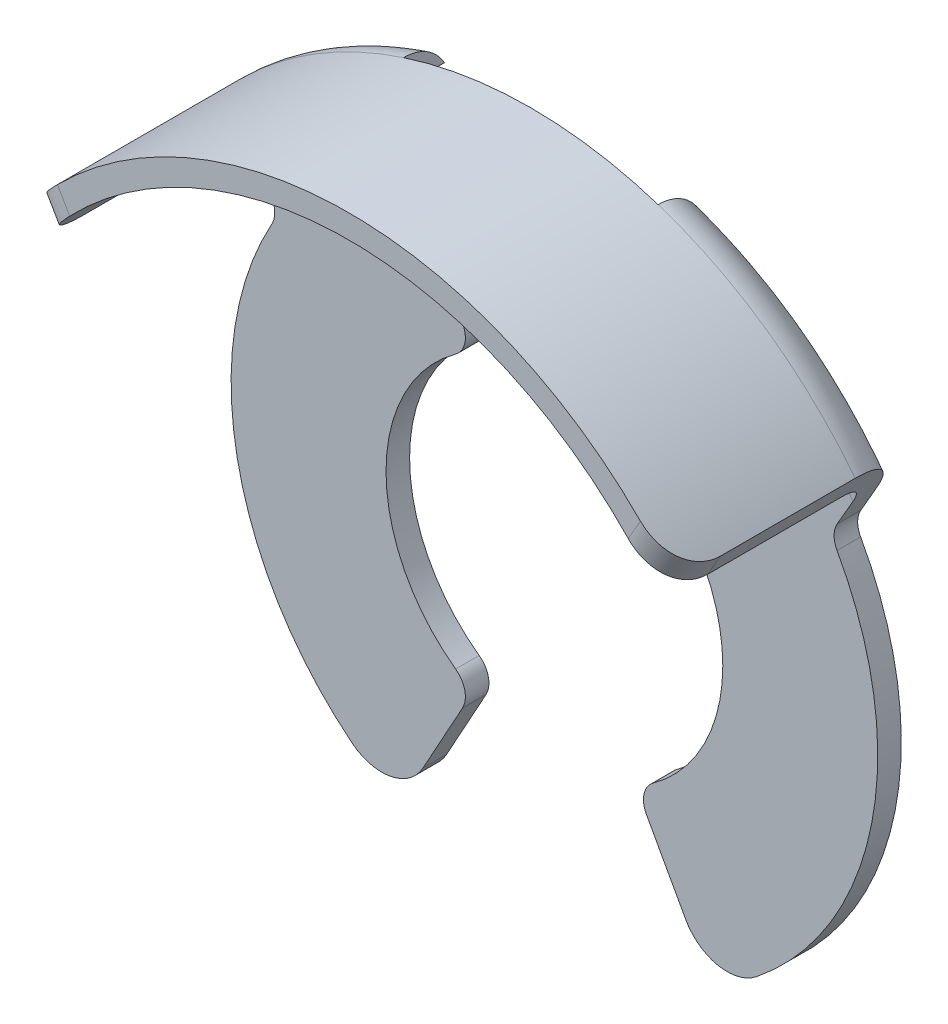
SolidWorks part; units mm, degrees
ref_plane "Front Plane" through (0, 0, 0) normal (0, 0, 1) x (1, 0, 0)
ref_plane "Top Plane" through (0, 0, 0) normal (0, 1, 0) x (1, 0, 0)
ref_plane "Right Plane" through (0, 0, 0) normal (1, 0, 0) x (0, 0, -1)
sketch "Sketch1" plane through (0, 0, 0) normal (0, 0, 1) x (1, 0, 0)
  circle A0 centre (0, 0) radius 5
  circle A1 centre (0, 0) radius 12.2
  dimension "D1" = 10
  dimension "D2" = 24.4
extrude "Boss-Extrude1" add sketch "Sketch1" against normal blind 6.8
sketch "Sketch2" plane through (0, 0, 0) normal (0, 0, 1) x (1, 0, 0)
  circle A0 centre (0, 0) radius 11.5
  dimension "D1" = 23
extrude "Cut-Extrude1" cut sketch "Sketch2" against normal blind 6.1
sketch "Sketch3" plane through (0, 0, 0) normal (0, 0, 1) x (1, 0, 0)
  line L0 (-9.6316, 7.4881) -> (-8.1951, 5)
  line L1 (9.6316, 7.4881) -> (8.1951, 5)
  circle A0 centre (0, 0) radius 12.2 construction
  arc A1 (-8.1951, 5) -> (8.1951, 5) centre (0, 0) ccw
  circle A2 centre (0, 0) radius 5 construction
  arc A4 (-9.6316, 7.4881) -> (9.6316, 7.4881) centre (0, 0) ccw
  point P7 (-9.6, 0)
  point P9 (9.6, 0)
  point P10 (0, 5)
  dimension "D1" = 60
  dimension "D2" = 19.2
extrude "Cut-Extrude2" cut sketch "Sketch3" against normal through all
sketch "Sketch4" plane through (0, 0, -6.1) normal (0, 0, 1) x (1, 0, 0)
  line L0 (0, 0) -> (-2.4137, -4.3788) construction
  line L1 (0, 0) -> (2.4137, -4.3788) construction
  line L2 (-2.4137, 4.3788) -> (-4.8286, 8.7598)
  line L3 (0, 0) -> (-2.4137, 4.3788) construction
  line L4 (0, 0) -> (2.4137, 4.3788) construction
  line L5 (4.8286, 8.7598) -> (2.4137, 4.3788)
  line L6 (2.4137, 4.3788) -> (2.4137, -4.3788) construction
  line L7 (-2.4137, 4.3788) -> (-2.4137, -4.3788) construction
  line L8 (-2.4137, -4.3788) -> (-3.9003, -7.0758)
  line L9 (2.4137, -4.3788) -> (3.9003, -7.0758)
  arc A0 (4.1019, 10.7436) -> (-4.1019, 10.7436) centre (0, 0) ccw
  arc A1 (9.2519, 6.8303) -> (-9.2519, 6.8303) centre (0, 0) ccw construction
  arc A2 (-2.4137, 4.3788) -> (-2.4137, -4.3788) centre (0, 0) ccw
  circle A3 centre (0, 0) radius 5 construction
  arc A4 (-4.8286, 8.7598) -> (-4.1019, 10.7436) centre (-3.6025, 9.4357) cw
  arc A6 (4.1019, 10.7436) -> (4.8286, 8.7598) centre (3.6025, 9.4357) cw
  arc A7 (-3.9003, -7.0758) -> (-6.0016, -7.4927) centre (-5.1264, -6.4) cw
  arc A8 (-8.1951, 5) -> (8.1951, 5) centre (0, 0) ccw construction
  arc A9 (3.9003, -7.0758) -> (6.0016, -7.4927) centre (5.1264, -6.4) ccw
  arc A10 (6.0016, -7.4927) -> (-6.0016, -7.4927) centre (0, 0) cw
  arc A11 (9.6316, 7.4881) -> (-9.6316, 7.4881) centre (0, 0) ccw construction
  arc A12 (2.4137, -4.3788) -> (2.4137, 4.3788) centre (0, 0) ccw
  point P1 (-5.1264, -7.8)
  point P30 (5.1264, -7.8)
  point P31 (0, 12.2)
  dimension "D2" = 1.4
  dimension "D1" = 20
extrude "Cut-Extrude3" cut sketch "Sketch4" against normal up to vertex
fillet "Fillet1" radius 1.4 3 edges at (0, 12.2, -6.8) (9.4417, 7.1592, 0) (-9.4417, 7.1592, 0)
fillet "Fillet2" radius 0.7 8 edges at (6.9577, 9.1565, -6.1) (-6.9577, 9.1565, -6.1) (-2.4137, -4.3788, -6.45) (2.4137, -4.3788, -6.45) (-2.4137, 4.3788, -6.45) (2.4137, 4.3788, -6.45) (-8.1951, 5, -6.45) (8.1951, 5, -6.45)
sketch "Sketch5" plane through (0, -4.5, -6.8) normal (0, 0, 1) x (1, 0, 0)
  line L0 (-3.7797, 11.357) -> (-3.7797, 16.7)
  line L5 (3.7797, 11.357) -> (3.7797, 16.7)
  line L6 (3.7797, 11.357) -> (-3.7797, 11.357)
  line L7 (2.7308, 9.4541) -> (4.8286, 13.2598) construction
  line L8 (-4.8286, 13.2598) -> (-2.7308, 9.4541) construction
  line L10 (-3.7797, 16.7) -> (3.7797, 16.7)
  arc A0 (9.6316, 11.9881) -> (-9.6316, 11.9881) centre (0, 4.5) ccw construction
extrude "Cut-Extrude5" cut sketch "Sketch5" along normal blind 1.4
